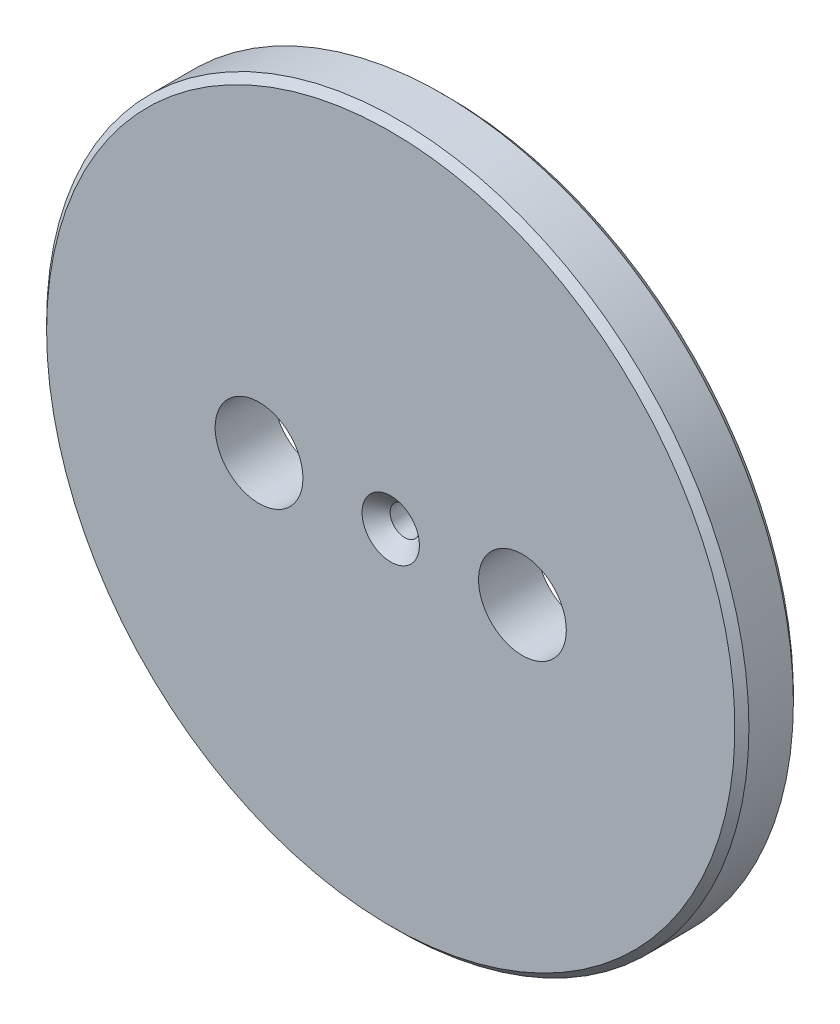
SolidWorks part; units mm, degrees
ref_plane "Front" through (0, 0, 0) normal (0, 0, 1) x (1, 0, 0)
ref_plane "Top" through (0, 0, 0) normal (0, 1, 0) x (1, 0, 0)
ref_plane "Right" through (0, 0, 0) normal (1, 0, 0) x (0, 0, -1)
sketch "Sketch1" plane through (0, 0, 0) normal (0, 0, 1) x (1, 0, 0)
  circle A0 centre (0, 0) radius 1.5875
  circle A1 centre (0, 0) radius 38.1
  dimension "D1" = 76.2
  dimension "D2" = 3.175
extrude "Base-Extrude" add sketch "Sketch1" along normal blind 4.7625
sketch "Sketch2" plane through (0, 0, 0) normal (0, 0, -1) x (-1, 0, 0)
  circle A0 centre (0, 0) radius 38.1 construction
  circle A1 centre (0, 0) radius 38.1
  circle A2 centre (0, 0) radius 4.7625
  dimension "D1" = 9.525
extrude "Boss-Extrude1" add sketch "Sketch2" along normal blind 1.5875
chamfer "screw hole c sink" distance 1.524 angle 45
chamfer "perimeter" distance 0.762 angle 45
sketch "Sketch3" plane through (0, 0, 4.7625) normal (0, 0, 1) x (1, 0, 0)
  circle A0 centre (-14.2875, 0) radius 4.7625
  circle A1 centre (14.2875, 0) radius 4.7625
  dimension "D1" = 9.525
  dimension "D2" = 9.525
extrude "wrench clearance holes" cut sketch "Sketch3" against normal through all
